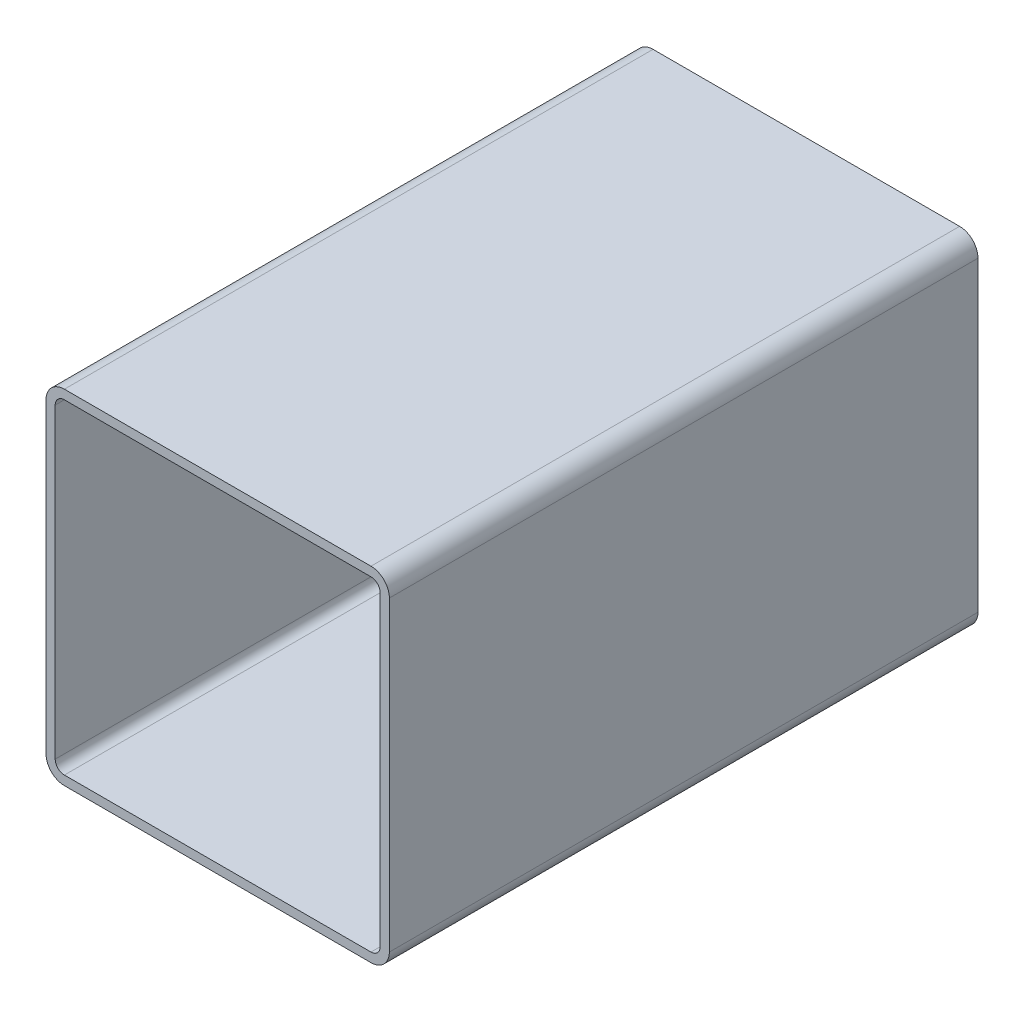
SolidWorks part; units mm, degrees
ref_plane "Front Plane" through (0, 0, 0) normal (0, 0, 1) x (1, 0, 0)
ref_plane "Top Plane" through (0, 0, 0) normal (0, 1, 0) x (1, 0, 0)
ref_plane "Right Plane" through (0, 0, 0) normal (1, 0, 0) x (0, 0, -1)
sketch "Sketch1" plane through (0, 0, 0) normal (0, 0, 1) x (1, 0, 0)
sketch_block_instance "HSS7x7x0.1875-1"
sketch_block "HSS7x7x0.1875"
extrude "Boss-Extrude1" add sketch "Sketch1" along normal blind 304.8
